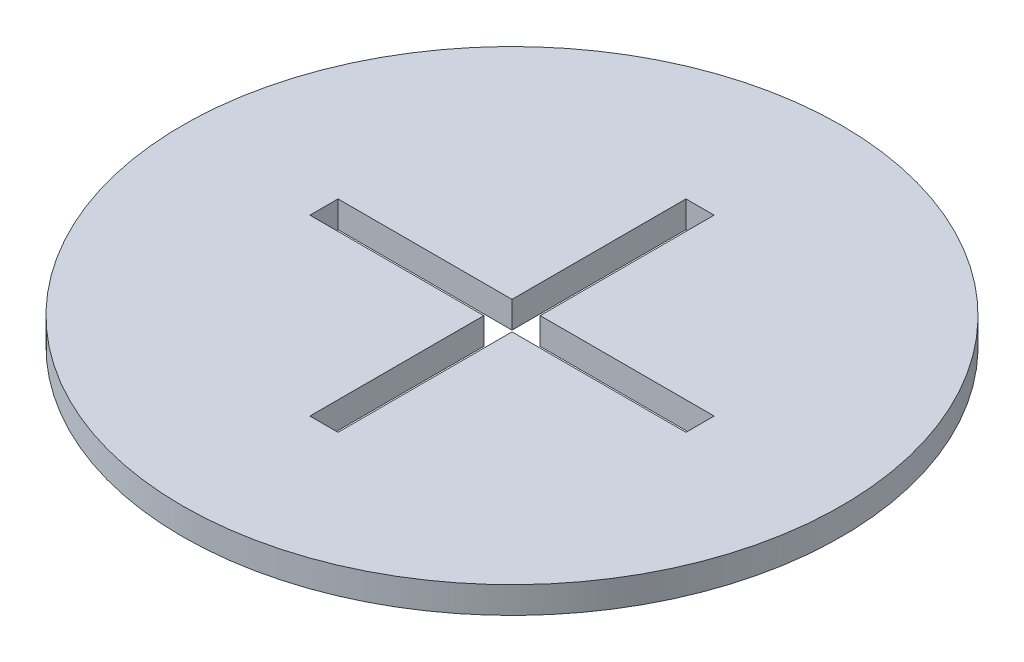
SolidWorks part; units mm, degrees
ref_plane "Piano frontale" through (0, 0, 0) normal (0, 0, 1) x (1, 0, 0)
ref_plane "Piano superiore" through (0, 0, 0) normal (0, 1, 0) x (1, 0, 0)
ref_plane "Piano destro" through (0, 0, 0) normal (1, 0, 0) x (0, 0, -1)
sketch "Schizzo6" plane through (0, 0, 0) normal (0, 1, 0) x (1, 0, 0)
  line B0 (95.5425, 213) -> (95.5425, 232)
  line B1 (95.5425, 232) -> (213, 232)
  line B2 (95.5425, 213) -> (213, 213)
  line B3 (232, 349.4575) -> (232, 232)
  line B4 (213, 349.4575) -> (213, 232)
  line B5 (213, 349.4575) -> (232, 349.4575)
  line B6 (349.4575, 213) -> (232, 213)
  line B7 (349.4575, 232) -> (232, 232)
  line B8 (349.4575, 232) -> (349.4575, 213)
  line B9 (213, 95.5425) -> (213, 213)
  line B10 (232, 95.5425) -> (232, 213)
  line B11 (232, 95.5425) -> (213, 95.5425)
  circle B12 centre (222.5, 222.5) radius 222.5
sketch_block_instance "Blocco11-2"
sketch_block "Blocco11" parameters "D1"=445, "D2"=27.6386
extrude "Estrusione-Estrusione2" add sketch "Schizzo6" along normal blind 18
